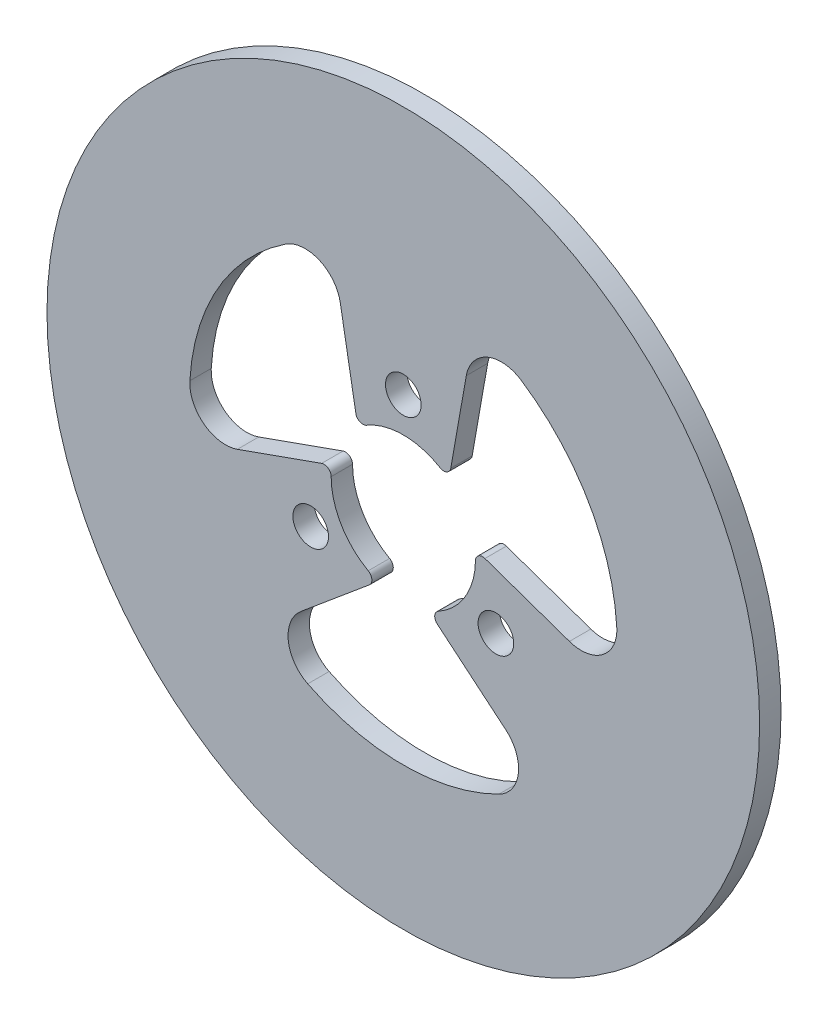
SolidWorks part; units mm, degrees
ref_plane "Plan1" through (0, 0, 0) normal (0, 0, 1) x (1, 0, 0)
ref_plane "Plan2" through (0, 0, 0) normal (0, 1, 0) x (1, 0, 0)
ref_plane "Plan3" through (0, 0, 0) normal (1, 0, 0) x (0, 0, -1)
sketch "Esquisse1" plane through (0, 0, 0) normal (0, 0, 1) x (1, 0, 0)
  line L0 (0, 0) -> (25.9808, -15) construction
  line L1 (0, 0) -> (-25.9808, -15) construction
  line L2 (0, 0) -> (0, 30) construction
  line L3 (-9.5324, -20.9791) -> (-28.7626, -37.0551)
  line L5 (9.5324, -20.9791) -> (28.7626, -37.0551)
  line L6 (22.9092, 1.658) -> (46.6194, -6.6363)
  line L7 (-13.3178, 18.7906) -> (-17.6773, 43.4806)
  line L8 (13.3178, 18.7906) -> (17.6773, 43.4806)
  line L9 (-22.9197, 1.8548) -> (-46.5688, -6.5496)
  circle A0 centre (0, 0) radius 100
  arc A1 (10.3282, 17.4181) -> (-10.3282, 17.4181) centre (0, 0) ccw
  arc A2 (-26.8186, -53.6728) -> (26.8186, -53.6728) centre (0, 0) ccw
  circle A3 centre (0, 30) radius 5
  circle A4 centre (-25.9808, -15) radius 5
  circle A5 centre (25.9808, -15) radius 5
  arc A6 (59.9057, 3.3633) -> (33.03, 50.0901) centre (0, 0) ccw
  arc A7 (-33.03, 50.0901) -> (-59.9009, 3.4477) centre (0, 0) ccw
  arc A8 (-20.25, -0.0271) -> (-9.8431, -17.6968) centre (0, 0) ccw
  arc A9 (9.8431, -17.6968) -> (20.2489, -0.2092) centre (0, 0) ccw
  arc A10 (-59.9009, 3.4477) -> (-46.5688, -6.5496) centre (-49.9174, 2.8731) ccw
  arc A11 (-17.6773, 43.4806) -> (-33.03, 50.0901) centre (-27.525, 41.7418) ccw
  arc A12 (33.03, 50.0901) -> (17.6773, 43.4806) centre (27.525, 41.7418) ccw
  arc A13 (46.6194, -6.6363) -> (59.9057, 3.3633) centre (49.9214, 2.8028) ccw
  arc A14 (26.8186, -53.6728) -> (28.7626, -37.0551) centre (22.3488, -44.7273) ccw
  arc A15 (-28.7626, -37.0551) -> (-26.8186, -53.6728) centre (-22.3488, -44.7273) ccw
  arc A16 (-20.25, -0.0271) -> (-22.9197, 1.8548) centre (-22.25, -0.0297) ccw
  arc A17 (-10.3282, 17.4181) -> (-13.3178, 18.7906) centre (-11.3483, 19.1384) cw
  arc A18 (13.3178, 18.7906) -> (10.3282, 17.4181) centre (11.3483, 19.1384) cw
  arc A19 (20.2489, -0.2092) -> (22.9092, 1.658) centre (22.2488, -0.2299) cw
  arc A20 (9.5324, -20.9791) -> (9.8431, -17.6968) centre (10.8152, -19.4446) cw
  arc A21 (-9.8431, -17.6968) -> (-9.5324, -20.9791) centre (-10.8152, -19.4446) cw
  point P14 (-58.9898, -10.9638)
  point P26 (-19.9889, 56.5725)
  point P29 (19.9889, 56.5725)
  point P32 (58.9898, -10.9638)
  point P35 (38.9898, -45.6048)
  point P38 (-38.9898, -45.6048)
  point P41 (-20.0447, 2.8765)
  point P50 (7.1156, -18.9587)
  point P53 (-7.1156, -18.9587)
  dimension "D1" = 200
  dimension "D2" = 40.5
  dimension "D3" = 10
  dimension "D6" = 120
  dimension "D7" = 10
  dimension "D14" = 2
  dimension "D4" = 120
  dimension "D5" = 120
  dimension "D8" = 39.9779
  dimension "D9" = 40
  dimension "D10" = 40
  dimension "D11" = 19.9889
  dimension "D12" = 20
  dimension "D13" = 20
extrude "Base-Extrusion" add sketch "Esquisse1" along normal blind 6
